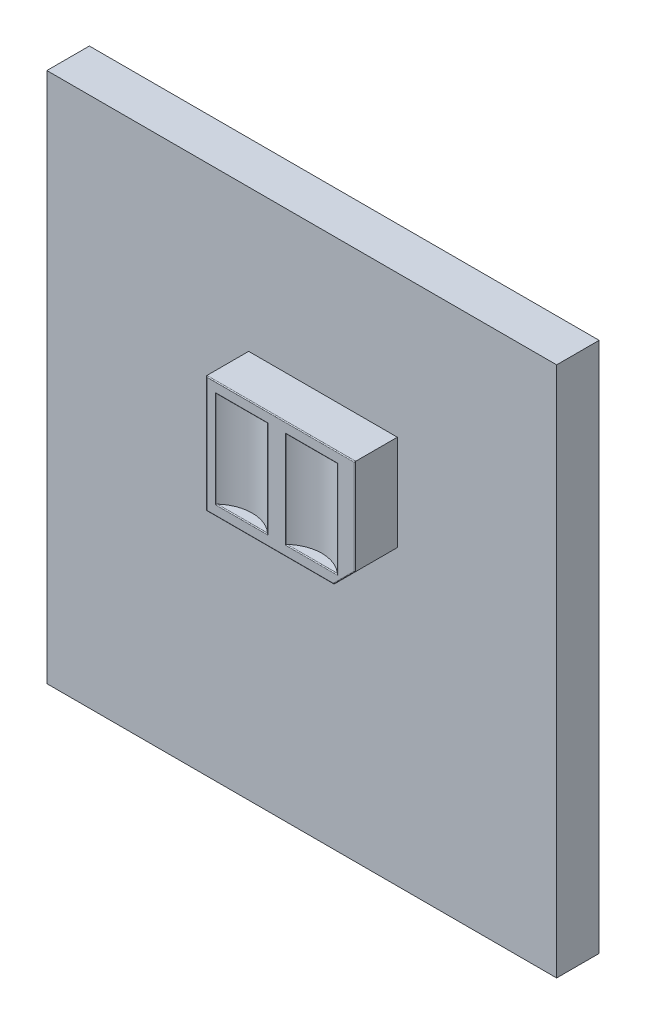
SolidWorks part; units mm, degrees
ref_plane "Face" through (0, 0, 0) normal (0, 0, 1) x (1, 0, 0)
ref_plane "Dessus" through (0, 0, 0) normal (0, 1, 0) x (1, 0, 0)
ref_plane "Droite" through (0, 0, 0) normal (1, 0, 0) x (0, 0, -1)
sketch "Esquisse1" plane through (0, 0, 0) normal (0, 0, 1) x (1, 0, 0)
  line L1 (-6, 6.25) -> (6, 6.25)
  line L2 (-6, 6.25) -> (-6, -6.25)
  line L3 (-6, -6.25) -> (6, -6.25)
  line L4 (6, 6.25) -> (6, -6.25)
  dimension "D1" = 6.25
  dimension "D2" = 12.5
  dimension "D3" = 6
  dimension "D4" = 12
extrude "Extrusion1" add sketch "Esquisse1" along normal blind 1
sketch "Esquisse5"
sketch "Esquisse3" plane through (0, 0, 0) normal (0, 0, 1) x (1, 0, 0)
  line L0 (-1.25, 2.9) -> (2.25, 2.9)
  line L1 (2.25, 2.9) -> (2.25, 0.65)
  line L2 (2.25, 0.65) -> (1.75, 0.15)
  line L3 (1.75, 0.15) -> (-1.25, 0.15)
  line L4 (-1.25, 0.15) -> (-1.25, 2.9)
  line L5 (-6, -6.25) -> (6, -6.25) construction
  line L6 (6, -6.25) -> (6, 6.25) construction
  point P9 (2.25, 0.15)
  dimension "D1" = 6.4
  dimension "D2" = 2.75
  dimension "D3" = 3.5
  dimension "D4" = 3.75
  dimension "D7" = 0.5
extrude "Extrusion2" add sketch "Esquisse3" along normal blind 2
ref_plane "Plan1" through (0, 0.4, 0) normal (0, -1, 0) x (1, 0, 0)
sketch "Esquisse4" plane through (0, 0.4, 0) normal (0, -1, 0) x (1, 0, 0)
  line L0 (0.4084, 2.8941) -> (0.4084, -0.6438) construction
  line L1 (0.6194, 2) -> (1.8396, 2)
  line L2 (-1.25, 2) -> (1.75, 2) construction
  line L3 (0.1974, 2) -> (-1.0228, 2)
  line L4 (1.75, 2) -> (2.25, 2) construction
  arc A0 (0.6194, 2) -> (1.8396, 2) centre (1.2295, 2.6375) ccw
  arc A1 (0.1974, 2) -> (-1.0228, 2) centre (-0.4127, 2.6375) cw
extrude "Enlèv. mat.-Extru.1" cut sketch "Esquisse4" against normal blind 2.25
fillet "Congé1" radius 0.02
